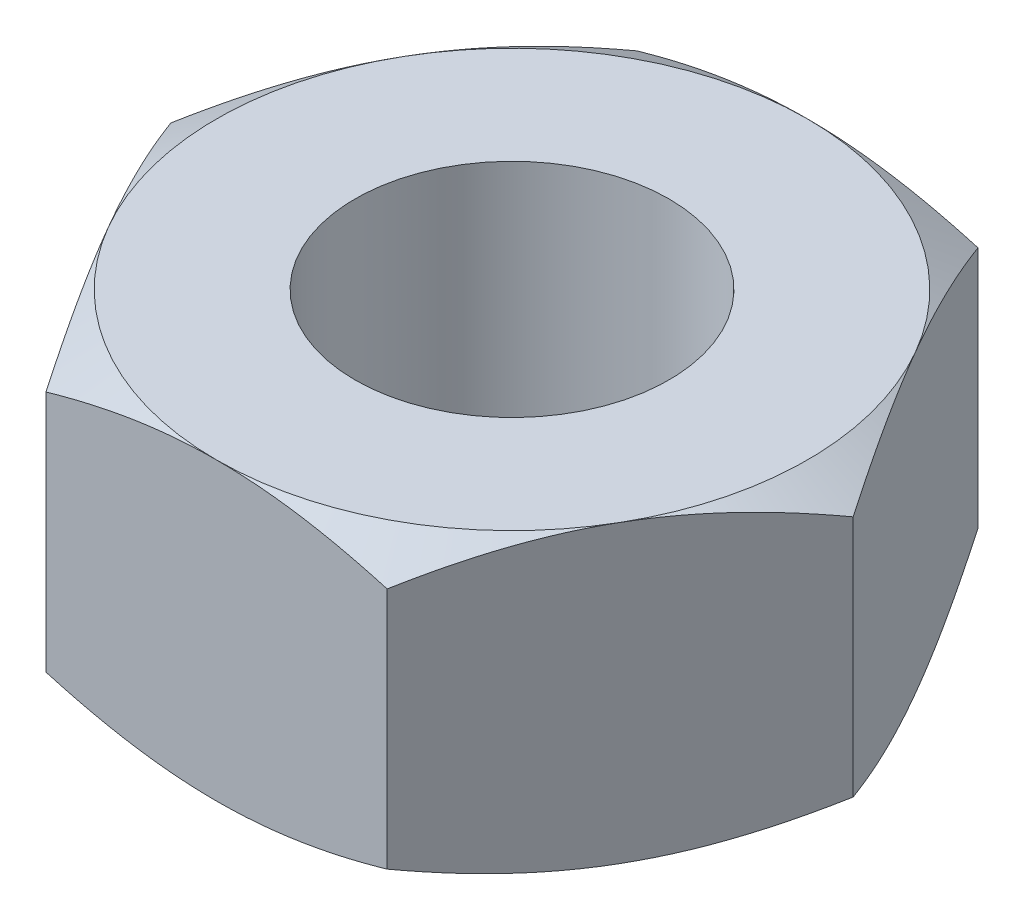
SolidWorks part; units mm, degrees
ref_plane "Front" through (0, 0, 0) normal (0, 0, 1) x (1, 0, 0)
ref_plane "Top" through (0, 0, 0) normal (0, 1, 0) x (1, 0, 0)
ref_plane "Right" through (0, 0, 0) normal (1, 0, 0) x (0, 0, -1)
sketch "Sketch1" plane through (0, 0, 0) normal (0, 1, 0) x (1, 0, 0)
  line L1 (11.0851, 0) -> (5.5426, 9.6)
  line L2 (5.5426, 9.6) -> (-5.5426, 9.6)
  line L3 (-5.5426, 9.6) -> (-11.0851, 0)
  line L4 (-11.0851, 0) -> (-5.5426, -9.6)
  line L5 (-5.5426, -9.6) -> (5.5426, -9.6)
  line L6 (5.5426, -9.6) -> (11.0851, 0)
  circle A0 centre (0, 0) radius 9.6 construction
  dimension "D1" = 19.2
extrude "Boss-Extrude1" add sketch "Sketch1" along normal blind 9.6
sketch "Sketch2" plane through (0, 9.6, 0) normal (0, 1, 0) x (1, 0, 0)
  line L0 (-5.5426, -9.6) -> (5.5426, -9.6) construction
  circle A0 centre (0, 0) radius 9.6
extrude "Cut-Extrude1" cut sketch "Sketch2" against normal blind 9.6 draft 60 flip side to cut
sketch "Sketch3" plane through (0, 0, 0) normal (0, -1, 0) x (1, 0, 0)
  circle A0 centre (0, 0) radius 9.6
extrude "Cut-Extrude2" cut sketch "Sketch3" against normal blind 9.6 draft 60 flip side to cut
hole_wizard "M12x1.75 Tapped Hole1" positions "Sketch5" profile "Sketch6" tap size "M12x1.75" standard "ANSI Metric"
sketch "Sketch5" plane through (0, 9.6, 0) normal (0, 1, 0) x (1, 0, 0)
  point P0 (0, 0)
sketch "Sketch6" plane through (0, 9.6, 0) normal (1, 0, 0) x (0, 0, 1)
  line L0 (0, 0) -> (0, 9.6)
  line L1 (0, 9.6) -> (5.1, 9.6)
  line L2 (5.1, 9.6) -> (5.1, 0)
  line L5 (5.1, 0) -> (0, 0)
  line L11 (0, -6.35) -> (0, 107.95) construction
  dimension "Thru Tap Drill Dia." = 10.2
  dimension "Thru Tap Drill Depth" = 9.6
